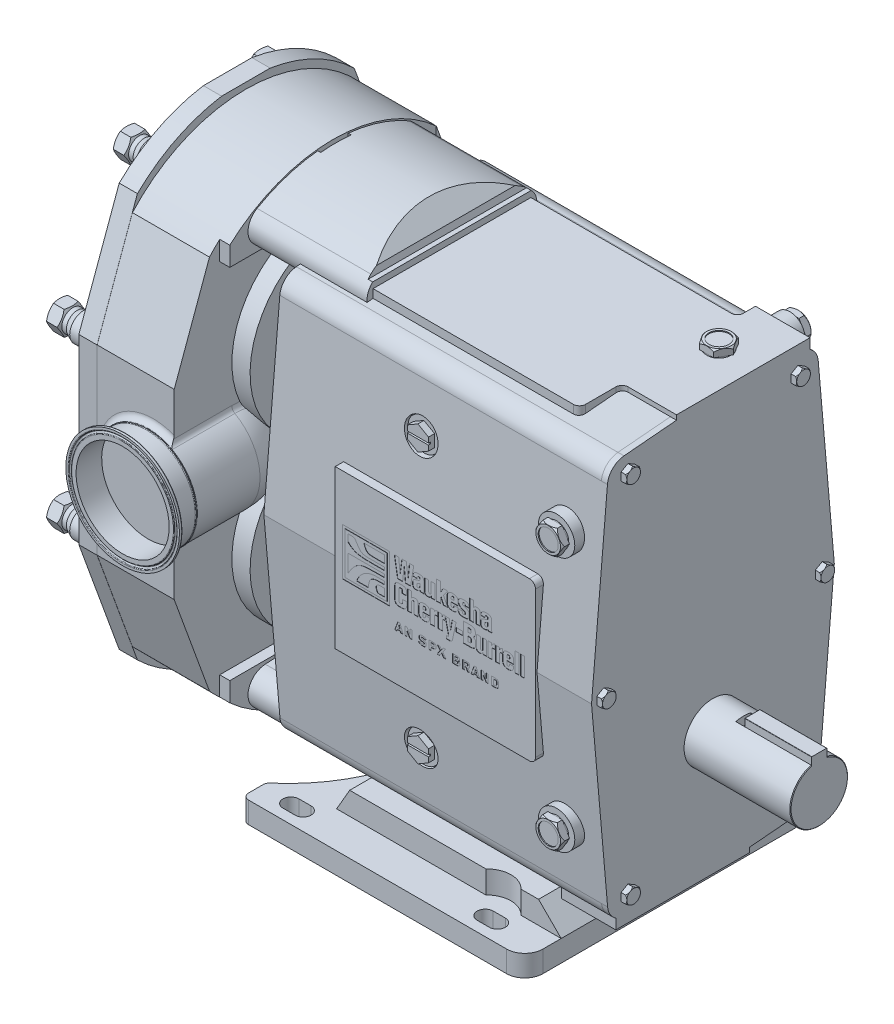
SolidWorks part; units mm, degrees
ref_plane "Front Plane" through (0, 0, 0) normal (0, 0, 1) x (1, 0, 0)
ref_plane "Top Plane" through (0, 0, 0) normal (0, 1, 0) x (1, 0, 0)
ref_plane "Right Plane" through (0, 0, 0) normal (1, 0, 0) x (0, 0, -1)
other "Join1"
other "108373<8>@210_U2_Lower Shaft"
other "108373<4>@210_U2_Lower Shaft"
other "108373<3>@210_U2_Lower Shaft"
other "108373<7>@210_U2_Lower Shaft"
other "oil plug<6>@210_U2_Lower Shaft"
other "108373<6>@210_U2_Lower Shaft"
other "grease fitting<4>@210_U2_Lower Shaft"
other "grease fitting<2>@210_U2_Lower Shaft"
other "cleanout plug<2>@210_U2_Lower Shaft"
other "oil plug<4>@210_U2_Lower Shaft"
other "108373<2>@210_U2_Lower Shaft"
other "Key_320<1>@210_U2_Lower Shaft"
other "Shaft_210<1>@210_U2_Lower Shaft"
other "new cover_gearcase_40669<1>@210_U2_Lower Shaft"
other "grease fitting<3>@210_U2_Lower Shaft"
other "grease fitting<1>@210_U2_Lower Shaft"
other "cleanout plug<1>@210_U2_Lower Shaft"
other "oil plug<5>@210_U2_Lower Shaft"
other "oil plug<3>@210_U2_Lower Shaft"
other "oil plug<2>@210_U2_Lower Shaft"
other "oil plug<1>@210_U2_Lower Shaft"
other "108373<5>@210_U2_Lower Shaft"
other "108373<1>@210_U2_Lower Shaft"
other "105406<1>@210_U2_Lower Shaft"
other "117523<1>@210_U2_Lower Shaft"
other "40288<1>@210_U2_Lower Shaft"
other "105478<1>@210_U2_Lower Shaft"
other "body_shim-210-320-370U2<2>@210_U2_Lower Shaft"
other "body_shim-210-320-370U2<1>@210_U2_Lower Shaft"
other "220360009<2>@210_U2_Lower Shaft"
other "220360009<1>@210_U2_Lower Shaft"
